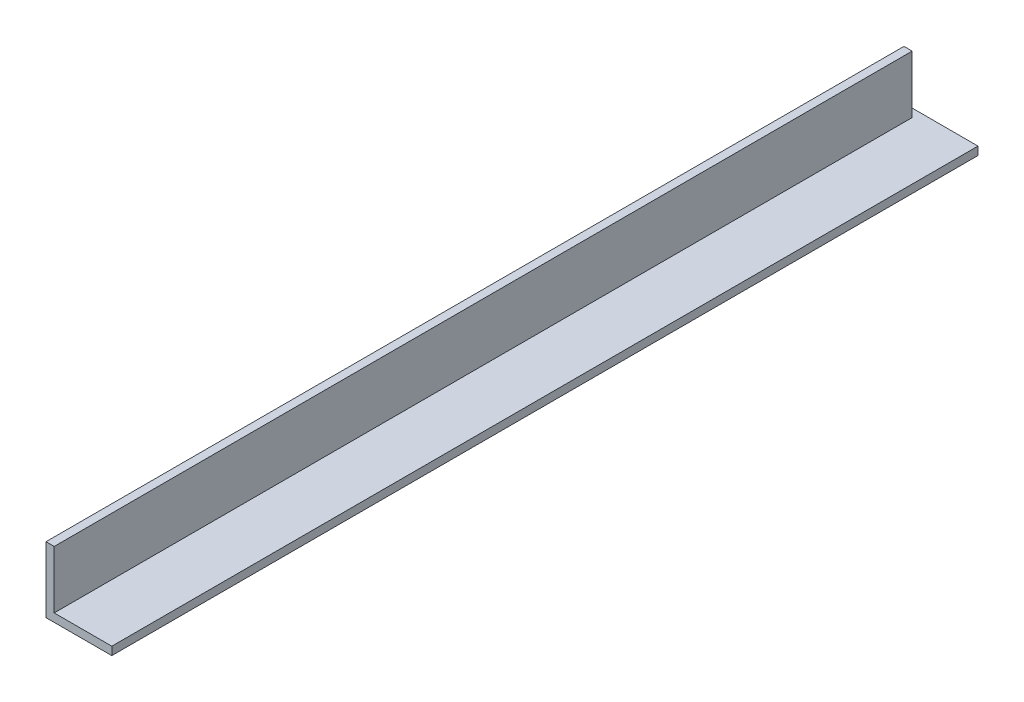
SolidWorks part; units mm, degrees
ref_plane "Front Plane" through (0, 0, 0) normal (0, 0, 1) x (1, 0, 0)
ref_plane "Top Plane" through (0, 0, 0) normal (0, 1, 0) x (1, 0, 0)
ref_plane "Right Plane" through (0, 0, 0) normal (1, 0, 0) x (0, 0, -1)
sketch "Sketch1" plane through (0, 0, 0) normal (0, 0, 1) x (1, 0, 0)
  line L0 (0, 0) -> (0, 38.1)
  line L1 (0, 0) -> (38.1, 0)
  line L2 (38.1, 0) -> (38.1, 4.7498)
  line L3 (38.1, 4.7498) -> (4.7498, 4.7498)
  line L4 (4.7498, 4.7498) -> (4.7498, 38.1)
  line L5 (4.7498, 38.1) -> (0, 38.1)
  dimension "D1" = 38.1
  dimension "D2" = 38.1
  dimension "D3" = 4.7498
  dimension "D4" = 4.7498
extrude "Boss-Extrude1" add sketch "Sketch1" along normal blind 501.65
sketch "Sketch2" plane through (0, 0, 0) normal (-1, 0, 0) x (0, 0, 1)
  line L0 (0, 4.7498) -> (4.7752, 4.7498)
  line L1 (0, 38.1) -> (0, 0) construction
  line L2 (4.7752, 4.7498) -> (4.7752, 38.1)
  line L3 (501.65, 38.1) -> (0, 38.1) construction
  line L4 (4.7752, 38.1) -> (0, 38.1)
  line L5 (0, 38.1) -> (0, 4.7498)
  line L6 (0, 4.7498) -> (0, 38.1) construction
  dimension "D1" = 4.7752
extrude "Cut-Extrude1" cut sketch "Sketch2" against normal up to next
